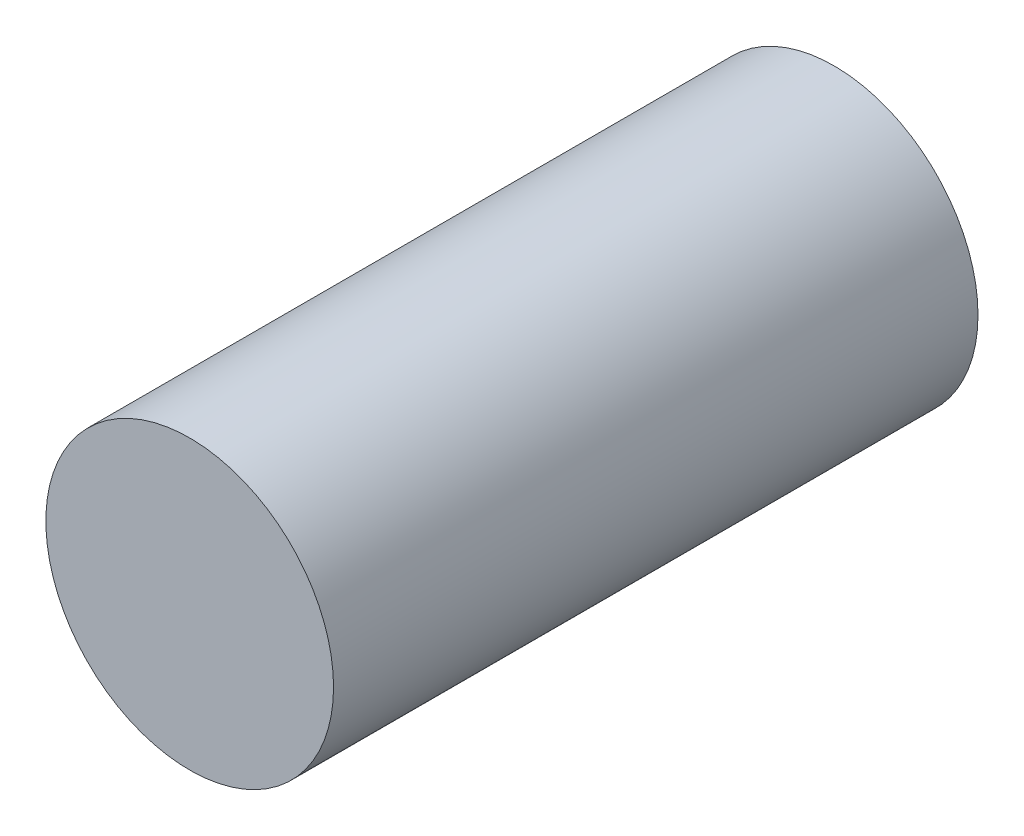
SolidWorks part; units mm, degrees
ref_plane "Face" through (0, 0, 0) normal (0, 0, 1) x (1, 0, 0)
ref_plane "Dessus" through (0, 0, 0) normal (0, 1, 0) x (1, 0, 0)
ref_plane "Droite" through (0, 0, 0) normal (1, 0, 0) x (0, 0, -1)
sketch "EsqCylindre" plane through (0, 0, 0) normal (0, 0, 1) x (1, 0, 0)
  circle A0 centre (0, 0) radius 25
  dimension "Diametre" = 50
extrude "Cylindre" add sketch "EsqCylindre" against normal blind 112
